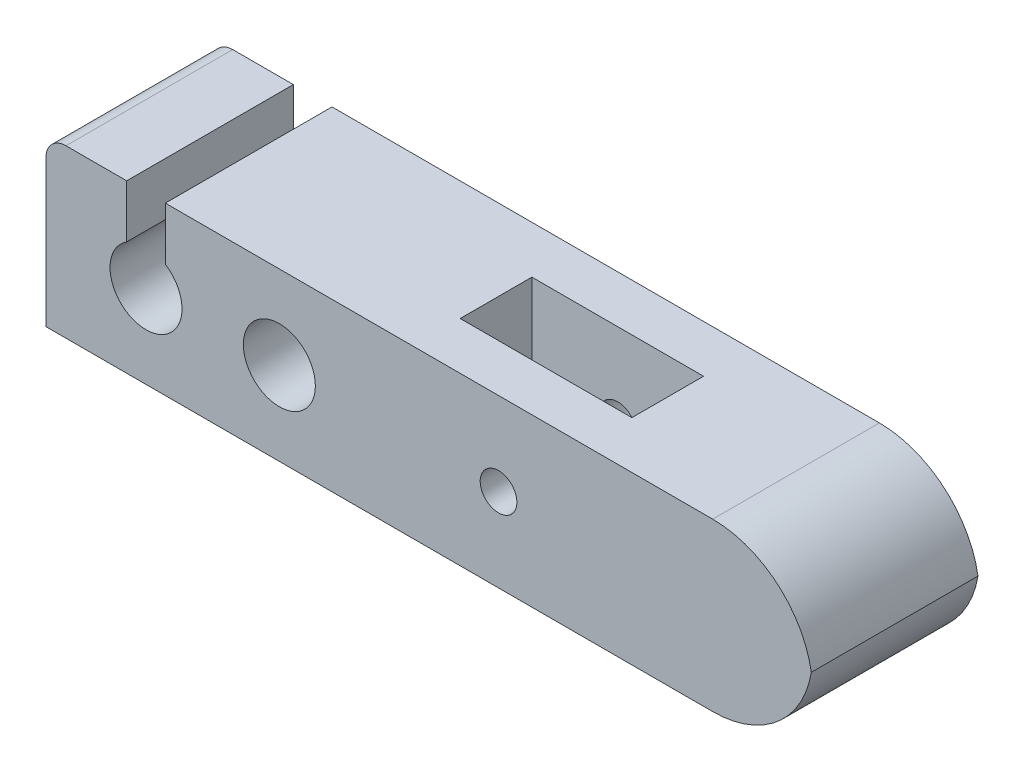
SolidWorks part; units mm, degrees
ref_plane "Front Plane" through (0, 0, 0) normal (0, 0, 1) x (1, 0, 0)
ref_plane "Top Plane" through (0, 0, 0) normal (0, 1, 0) x (1, 0, 0)
ref_plane "Right Plane" through (0, 0, 0) normal (1, 0, 0) x (0, 0, -1)
sketch "Sketch1" plane through (0, 0, 0) normal (0, 0, 1) x (1, 0, 0)
  line L0 (-102.9, 17.06) -> (-102.9, 25)
  line L1 (0, 0) -> (-115, 0)
  line L2 (0, 0) -> (0, 25)
  line L3 (0, 25) -> (-115, 25)
  line L4 (-115, 0) -> (-115, 25)
  line L5 (-97.1, 17.06) -> (-97.1, 25)
  circle A0 centre (-100, 12.5048) radius 5.4
  circle A1 centre (-80, 12.5) radius 5.4
  dimension "D3" = 10.8
  dimension "D7" = 35
  dimension "D8" = 12.5
  dimension "D9" = 10.8
  dimension "D1" = 115
  dimension "D2" = 25
  dimension "D4" = 5.8
  dimension "D5" = 15
  dimension "D6" = 7.94
extrude "Boss-Extrude1" add sketch "Sketch1" along normal blind 25 contours A0 L0 L3 L4 L1 L2 L5 A1
ref_plane "Plane2" through (-97.1, 25, 25) normal (0, 1, 0) x (1, 0, 0)
sketch "Sketch2" plane through (-97.1, 25, 25) normal (0, 1, 0) x (1, 0, 0)
  line L0 (49.975, 17.875) -> (49.975, 25) construction
  line L1 (37.1, 17.875) -> (62.85, 17.875)
  line L2 (37.1, 17.875) -> (37.1, 7.125)
  line L3 (37.1, 7.125) -> (62.85, 7.125)
  line L4 (62.85, 17.875) -> (62.85, 7.125)
  line L5 (97.1, 25) -> (0, 25) construction
  line L6 (49.975, 7.125) -> (49.975, 0) construction
  line L7 (97.1, 0) -> (0, 0) construction
  line L8 (-17.9, 0) -> (-17.9, 25) construction
  dimension "D1" = 10.75
  dimension "D2" = 25.75
  dimension "D3" = 55
extrude "Cut-Extrude1" cut sketch "Sketch2" against normal up to surface (25 mm away)
sketch "Sketch7" plane through (0, 0, 7.125) normal (0, 0, 1) x (1, 0, 0)
  line L0 (-47.125, 12.5) -> (-47.125, 0) construction
  line L1 (-34.25, 0) -> (-60, 0) construction
  line L2 (-47.125, 12.5) -> (-47.125, 25) construction
  line L3 (-34.25, 25) -> (-60, 25) construction
  circle A0 centre (-47.125, 12.5) radius 2.75
  dimension "D1" = 5.5
extrude "Cut-Extrude3" cut sketch "Sketch7" against normal through all both and the other way through all
fillet "Fillet1" radius 15 2 edges at (0, 25, 12.5) (0, 0, 12.5)
fillet "Fillet3" radius 3 1 edges at (-115, 25, 12.5)
